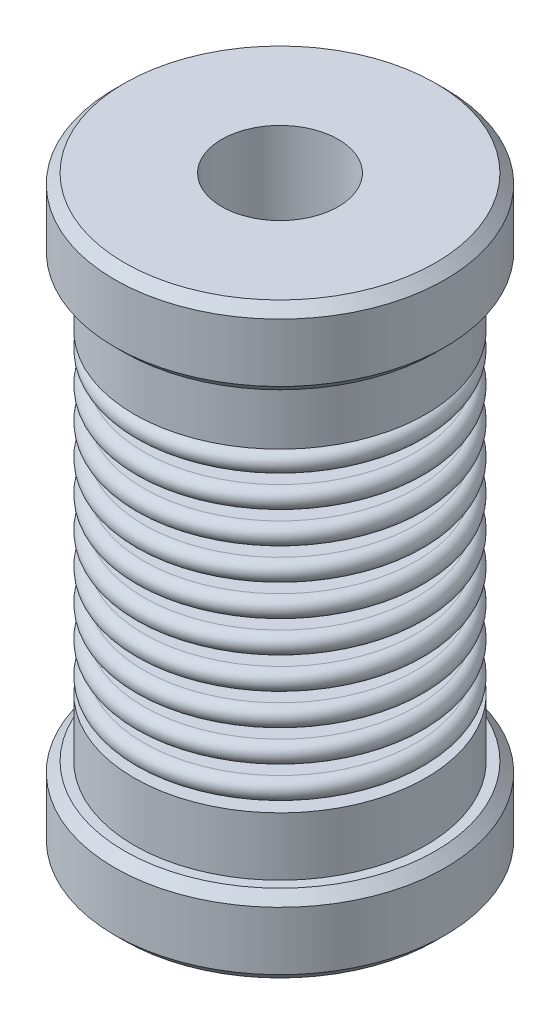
SolidWorks part; units mm, degrees
ref_plane "Plan1" through (0, 0, 0) normal (0, 0, 1) x (1, 0, 0)
ref_plane "Plan2" through (0, 0, 0) normal (0, 1, 0) x (1, 0, 0)
ref_plane "Plan3" through (0, 0, 0) normal (1, 0, 0) x (0, 0, -1)
sketch "Esquisse1" plane through (0, 0, 0) normal (0, 0, 1) x (1, 0, 0)
  line L0 (0, -34.7879) -> (0, 9.2243) construction
  line L1 (3, 0) -> (3, -30.2)
  line L2 (3, -30.2) -> (8.5, -30.2)
  line L3 (8.5, -30.2) -> (8.5, -26.2)
  line L4 (8.5, -26.2) -> (7.5, -26.2)
  line L5 (7.5, -26.2) -> (7.5, -23.2)
  line L6 (7.5, -23.2) -> (5.5, -23.2)
  line L7 (5.5, -23.2) -> (5.5, -7)
  line L8 (5.5, -7) -> (7.5, -7)
  line L9 (7.5, -7) -> (7.5, -4)
  line L10 (7.5, -4) -> (8.5, -4)
  line L11 (8.5, -4) -> (8.5, 0)
  line L12 (8.5, 0) -> (3, 0)
  dimension "D1" = 30.2
  dimension "D2" = 17
  dimension "D3" = 7
  dimension "D4" = 7
  dimension "D5" = 4
  dimension "D6" = 4
  dimension "D7" = 3
  dimension "D8" = 1
  dimension "D9" = 2
revolve "Base-Révolution" add sketch "Esquisse1" angle 360 about L0
sketch "Esquisse2" plane through (0, 0, 0) normal (1, 0, 0) x (0, 0, -1)
  line L0 (5.5, -7.31) -> (5.5, -8.31)
  line L1 (5.5, -23.2) -> (5.5, -7) construction
  line L2 (5.5, -7.31) -> (7, -7.31)
  line L3 (5.5, -8.31) -> (7, -8.31)
  line L4 (7.5, -7) -> (7.5, -4) construction
  line L5 (0, -6.0701) -> (0, -11.6999) construction
  line L6 (0, -34.7879) -> (0, 9.2243) construction
  line L7 (-7.5, -7) -> (7.5, -7) construction
  arc A0 (7, -7.31) -> (7, -8.31) centre (7, -7.81) cw
  dimension "D1" = 1
  dimension "D2" = 0.5
  dimension "D3" = 0.31
revolve "Boss.-Révol.1" add sketch "Esquisse2" angle 360 about L5
pattern_linear "Répétition linéaire1" count 10 spacing 1.62 along (0, 1, 0)
chamfer "Chanfrein1" distance 0.5 angle 45
